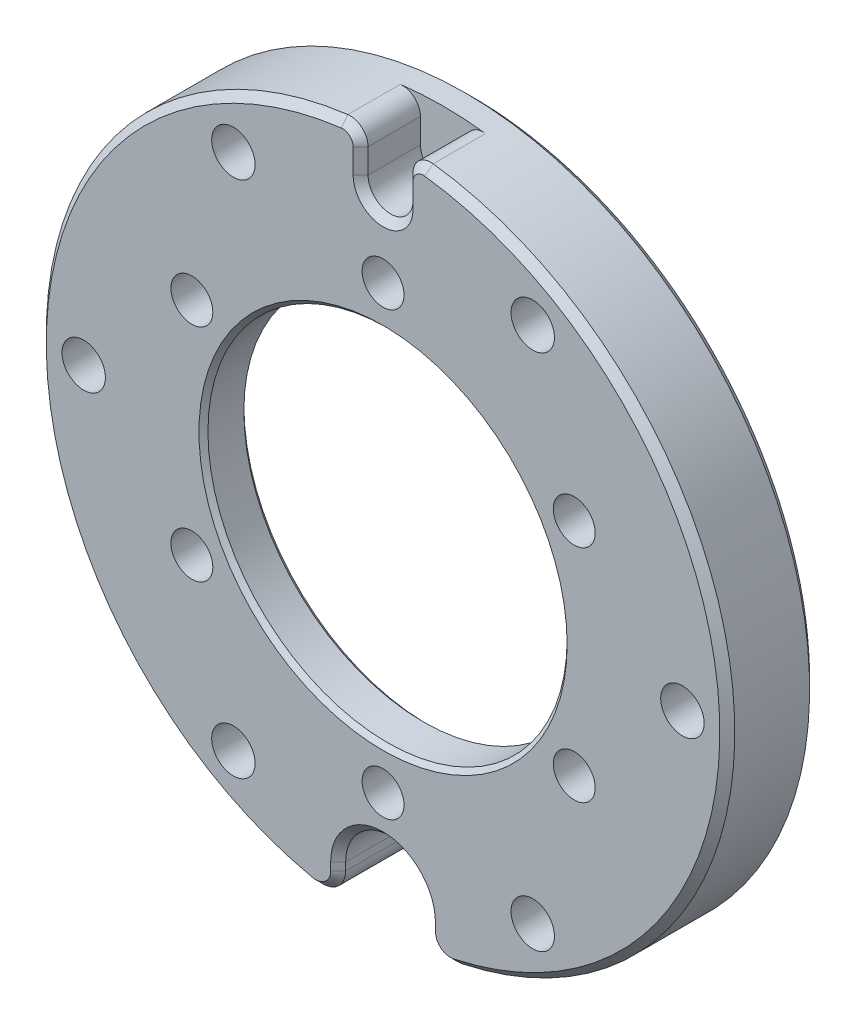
SolidWorks part; units mm, degrees
ref_plane "前视基准面" through (0, 0, 0) normal (0, 0, 1) x (1, 0, 0)
ref_plane "上视基准面" through (0, 0, 0) normal (0, 1, 0) x (1, 0, 0)
ref_plane "右视基准面" through (0, 0, 0) normal (1, 0, 0) x (0, 0, -1)
other "Configuration Table"
sketch "草图1" plane through (0, 0, 0) normal (1, 0, 0) x (0, 0, -1)
  line L0 (0, 0) -> (-19.3643, 0) construction
  line L1 (0, 0) -> (0, 16.5)
  line L2 (0, 16.5) -> (3, 16.5)
  line L3 (3, 16.5) -> (3, 23)
  line L4 (3, 23) -> (-3, 23)
  line L5 (-3, 23) -> (-3, 0)
  line L6 (-3, 0) -> (0, 0)
  dimension "D1" = 33
  dimension "D2" = 3
  dimension "D3" = 6
  dimension "D4" = 6.5
revolve "旋转1" add sketch "草图1" angle 360 about L0
sketch "草图2" plane through (0, 0, 3) normal (0, 0, 1) x (1, 0, 0)
  line L0 (0, 0) -> (0, 14.75) construction
  circle A0 centre (0, 0) radius 14.75 construction
  circle A1 centre (0, 14.75) radius 1.4
  dimension "D1" = 29.5
  dimension "D2" = 2.8
extrude "切除-拉伸1" cut sketch "草图2" against normal through all both and the other way through all
pattern_circular "阵列(圆周)1" count 6 over 360 about axis through (0, 0, 0) along (0, 0, 1) of "切除-拉伸1"
sketch "草图3" plane through (0, 0, 3) normal (0, 0, 1) x (1, 0, 0)
  circle A0 centre (0, 0) radius 12
  dimension "D1" = 24
extrude "切除-拉伸2" cut sketch "草图3" against normal through all both and the other way through all
sketch "草图6" plane through (0, 0, -3) normal (0, 0, -1) x (-1, 0, 0)
  line L0 (0, 0) -> (10, 17.3205) construction
  line L1 (0, 0) -> (0, 35.4504) construction
  circle A0 centre (0, 0) radius 20 construction
  dimension "D1" = 40
  dimension "D2" = 30
hole_wizard "打孔尺寸(%根据)内六角圆柱头螺钉的类型1" positions "3D草图1" profile "草图7" counterbore size "M2.5" standard "GB"
sketch3d "3D草图1"
  point P0 (-10, 17.3205, -3)
sketch "草图7" plane through (-10, 17.3205, -3) normal (1, 0, 0) x (0, 1, 0)
  line L0 (0, 0) -> (0, 6)
  line L1 (0, 6) -> (1.45, 6)
  line L3 (1.45, 6) -> (1.45, 2.9)
  line L4 (1.45, 2.9) -> (2.5, 2.9)
  line L5 (2.5, 2.9) -> (2.5, 0)
  line L7 (2.5, 0) -> (0, 0)
  line L11 (0, -6.35) -> (0, 107.95) construction
  dimension "通孔孔直径" = 2.9
  dimension "通孔孔深度" = 6
  dimension "柱形沉头孔直径" = 5
  dimension "柱形沉头孔深度" = 2.9
pattern_circular "阵列(圆周)2" count 6 over 360 about axis through (0, 0, 0) along (0, 0, 1) of "打孔尺寸(%根据)内六角圆柱头螺钉的类型1"
sketch "草图9" plane through (0, 0, 3) normal (0, 0, -1) x (-1, 0, 0)
  line L0 (0, 20) -> (0, 24.7081) construction
  line L1 (0, 0) -> (0, 35.4504) construction
  line L2 (-1.5, 20) -> (-1.5, 24.7081)
  line L3 (1.5, 20) -> (1.5, 24.7081)
  arc A0 (-1.5, 20) -> (1.5, 20) centre (0, 20) ccw
  arc A1 (1.5, 24.7081) -> (-1.5, 24.7081) centre (0, 24.7081) ccw
  point P4 (0, 22.3541)
  dimension "D2" = 1.5
  dimension "D1" = 20
extrude "切除-拉伸3" cut sketch "草图9" along normal blind 4
fillet "圆角1" radius 1.2 2 edges at (1.5, 22.951, 1) (-1.5, 22.951, 1)
sketch "草图10" plane through (0, 0, -3) normal (0, 0, -1) x (-1, 0, 0)
  line L0 (0, 0) -> (0, -28.6925) construction
  line L1 (0, -31.0721) -> (0, -20.5) construction
  line L2 (-3, -31.0721) -> (-3, -20.5)
  line L3 (3, -31.0721) -> (3, -20.5)
  arc A0 (-3, -31.0721) -> (3, -31.0721) centre (0, -31.0721) ccw
  arc A1 (3, -20.5) -> (-3, -20.5) centre (0, -20.5) ccw
  point P5 (0, -25.786)
  dimension "D1" = 3
  dimension "D2" = 20.5
extrude "切除-拉伸4" cut sketch "草图10" against normal through all
fillet "圆角2" radius 1.5 2 edges at (3, -22.8035, 0) (-3, -22.8035, 0)
chamfer "倒角1" distance 0.5 angle 45 18 edges at (22.9784, 0.9966, 3) (3.5568, -22.1902, 3) (1.9058, 22.5317, 3) (3, -20.7619, 3) (1.5, 20.8161, 3) (0, -17.5, 3) (0, 18.5, 3) (-3, -20.7619, 3) (-1.5, 20.8161, 3) (-3.5568, -22.1902, 3) (-1.9058, 22.5317, 3) (-22.9784, 0.9966, 3) (0, -17.5, -3) (-3, -20.7619, -3) (3, -20.7619, -3) (-3.5568, -22.1902, -3) (3.5568, -22.1902, -3) (0, 23, -3)
chamfer "倒角2" distance 0.5 angle 45 1 edges at (-16.5, 0, -3)
chamfer "倒角3" distance 0.3 angle 45 2 edges at (12, 0, 3) (-12, 0, 0)
